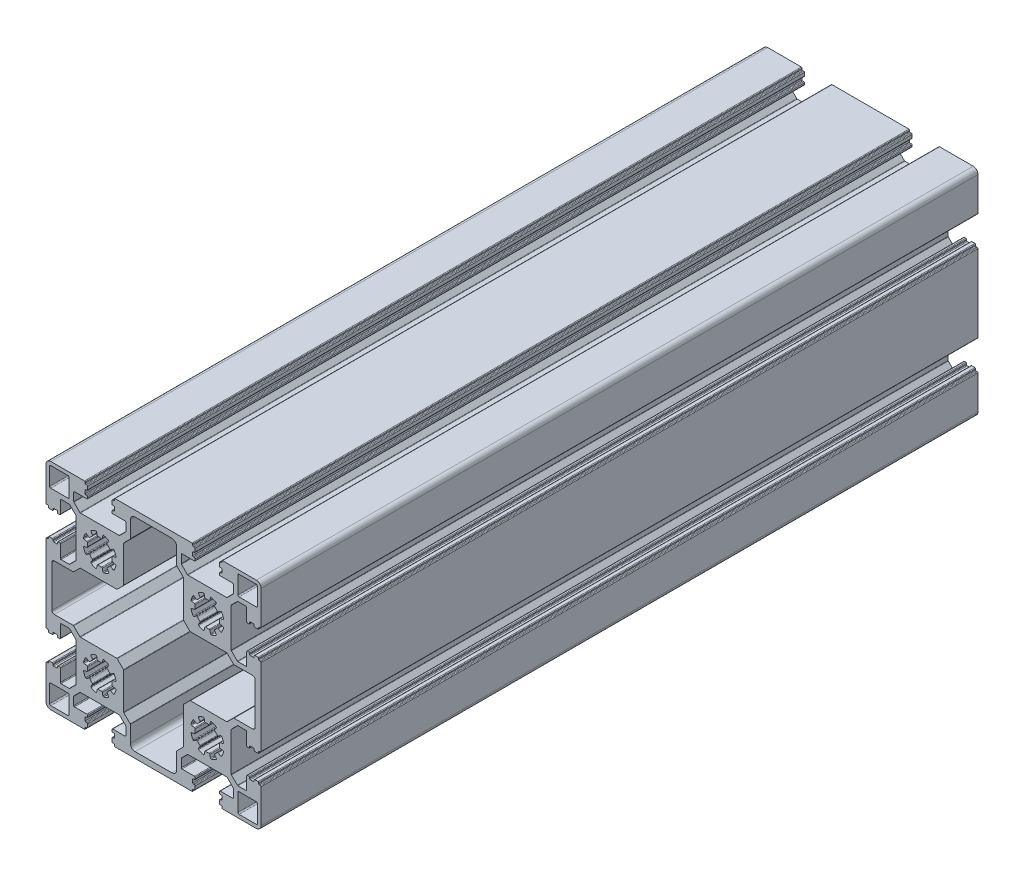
SolidWorks part; units mm, degrees
ref_plane "前视基准面" through (0, 0, 0) normal (0, 0, 1) x (1, 0, 0)
ref_plane "上视基准面" through (0, 0, 0) normal (0, 1, 0) x (1, 0, 0)
ref_plane "右视基准面" through (0, 0, 0) normal (1, 0, 0) x (0, 0, -1)
sketch "草图1"
sketch_block_instance "A$C6581020B-1"
sketch_block "A$C6581020B"
extrude "凸台-拉伸1" add sketch "草图1" along normal mid plane 300
